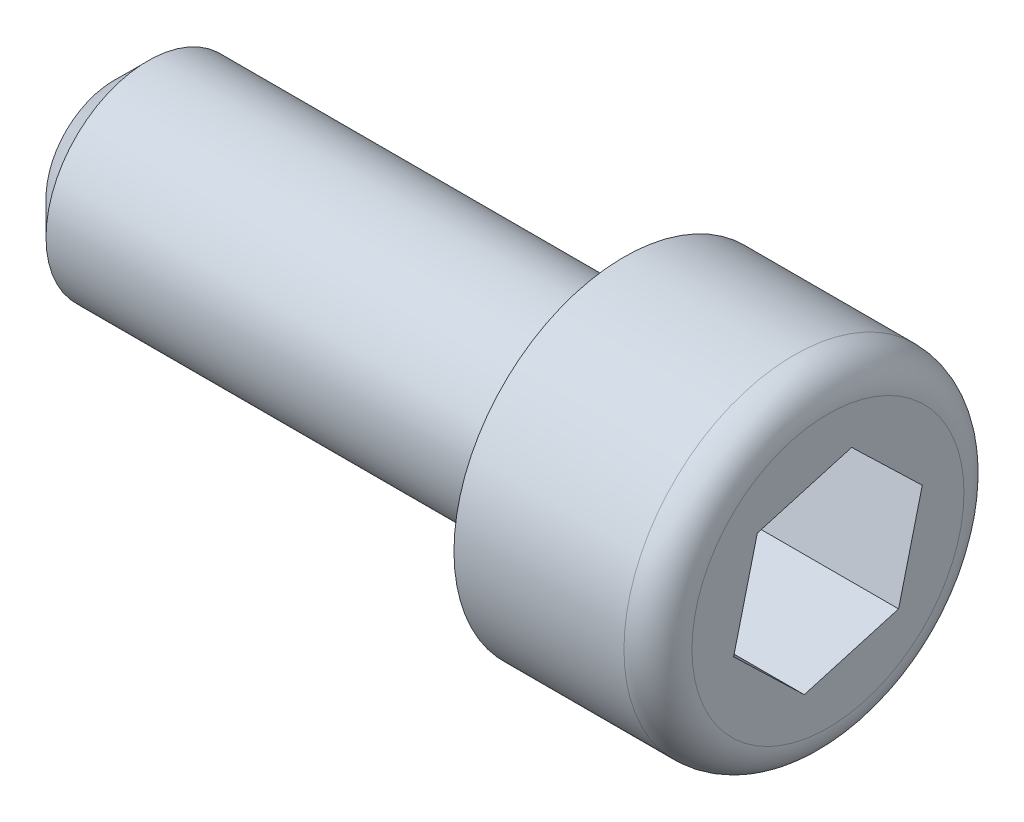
SolidWorks part; units mm, degrees
ref_plane "Plan1" through (0, 0, 0) normal (0, 0, 1) x (1, 0, 0)
ref_plane "Plan2" through (0, 0, 0) normal (0, 1, 0) x (1, 0, 0)
ref_plane "Plan3" through (0, 0, 0) normal (1, 0, 0) x (0, 0, -1)
sketch "Esquisse1" plane through (0, 0, 0) normal (0, 0, 1) x (1, 0, 0)
  line L0 (0, 0) -> (0, 5)
  line L1 (0, 5) -> (-6, 5)
  line L2 (-6, 5) -> (-6, 3)
  line L3 (-6, 3) -> (-21, 3)
  line L4 (-21, 3) -> (-21, 0)
  line L5 (-41, 0) -> (109, 0) construction
  line L6 (0, 0) -> (-21, 0)
  dimension "D1" = 3
  dimension "D2" = 15
  dimension "D3" = 6
  dimension "D4" = 2
  dimension "D5" = 5
revolve "Base-Révolution" add sketch "Esquisse1" angle 360 about L5
chamfer "Chanfrein1" distance 1 angle 45
fillet "Congé1" radius 1
sketch "Esquisse2" plane through (0, 0, 0) normal (1, 0, 0) x (0, 0, -1)
  line L1 (2.078, -2.0038) -> (2.7743, 0.7977)
  line L2 (2.7743, 0.7977) -> (0.6963, 2.8015)
  line L3 (0.6963, 2.8015) -> (-2.078, 2.0038)
  line L4 (-2.078, 2.0038) -> (-2.7743, -0.7977)
  line L5 (-2.7743, -0.7977) -> (-0.6963, -2.8015)
  line L6 (-0.6963, -2.8015) -> (2.078, -2.0038)
  circle A0 centre (0, 0) radius 2.5 construction
extrude "Enlèv. mat.-Extru.1" cut sketch "Esquisse2" against normal blind 5
